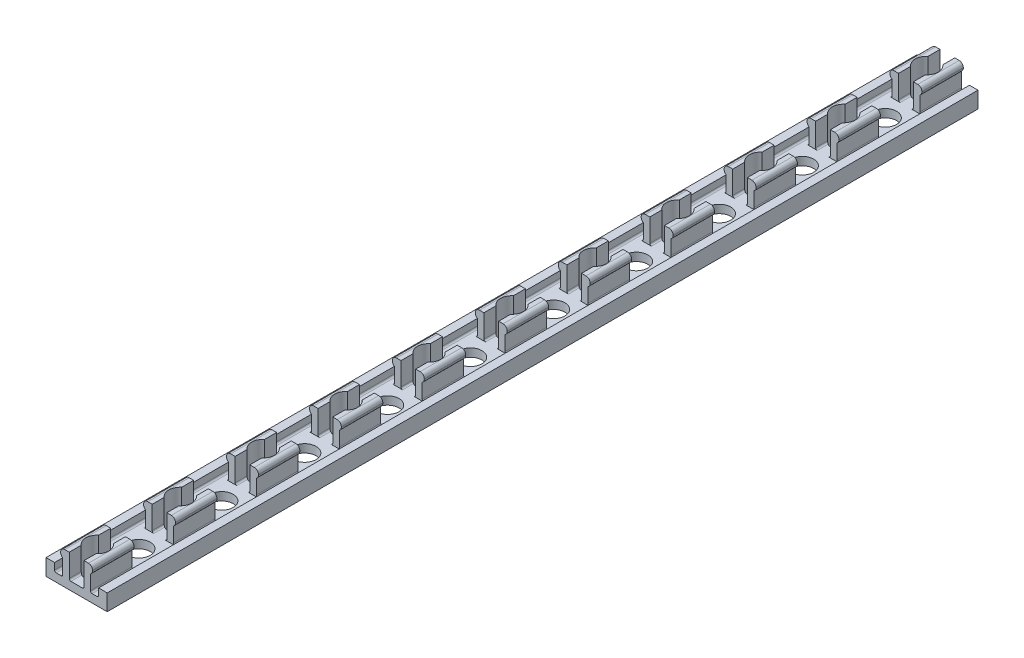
SolidWorks part; units mm, degrees
ref_plane "前视基准面" through (0, 0, 0) normal (0, 0, 1) x (1, 0, 0)
ref_plane "上视基准面" through (0, 0, 0) normal (0, 1, 0) x (1, 0, 0)
ref_plane "右视基准面" through (0, 0, 0) normal (1, 0, 0) x (0, 0, -1)
sketch "草图1" plane through (0, 0, 0) normal (0, 0, 1) x (1, 0, 0)
  line L0 (0, 0) -> (0, 44.5431) construction
  line L1 (-3.75, 0) -> (-3.75, 2)
  line L2 (-3.75, 2) -> (-1.7, 2)
  line L3 (-1.7, 2) -> (-1.7, 3)
  line L4 (-1.7, 3) -> (-1.95, 3)
  line L5 (-1.95, 3) -> (-1.95, 4)
  line L6 (-1.95, 4) -> (1.95, 4)
  line L8 (1.95, 3) -> (1.95, 4)
  line L9 (1.7, 3) -> (1.95, 3)
  line L10 (1.7, 2) -> (1.7, 3)
  line L11 (3.75, 2) -> (1.7, 2)
  line L12 (3.75, 0) -> (3.75, 2)
  line L13 (-3.75, 0) -> (3.75, 0)
  dimension "D1" = 2
  dimension "D2" = 1
  dimension "D3" = 1
  dimension "D4" = 3.4
  dimension "D5" = 7.5
  dimension "D6" = 3.9
extrude "凸台-拉伸1" add sketch "草图1" along normal blind 106.68
sketch "草图2" plane through (0, 0, 0) normal (0, -1, 0) x (1, 0, 0)
  line L0 (0, 106.68) -> (0, 419.4264) construction
  line L1 (-3.75, 106.68) -> (3.75, 106.68) construction
  line L2 (-3.75, 53.34) -> (35.5826, 53.34) construction
  line L3 (-3.75, 106.68) -> (-3.75, 0) construction
  circle A0 centre (0, 104.14) radius 1.4
  circle A1 centre (0, 99.06) radius 1.4
  circle A2 centre (0, 93.98) radius 1.4
  circle A3 centre (0, 88.9) radius 1.4
  circle A4 centre (0, 83.82) radius 1.4
  circle A5 centre (0, 78.74) radius 1.4
  circle A6 centre (0, 73.66) radius 1.4
  circle A7 centre (0, 68.58) radius 1.4
  circle A8 centre (0, 63.5) radius 1.4
  circle A9 centre (0, 58.42) radius 1.4
  circle A10 centre (0, 53.34) radius 1.4
  circle A11 centre (0, 48.26) radius 1.4
  circle A12 centre (0, 43.18) radius 1.4
  circle A13 centre (0, 38.1) radius 1.4
  circle A14 centre (0, 33.02) radius 1.4
  circle A15 centre (0, 27.94) radius 1.4
  circle A16 centre (0, 22.86) radius 1.4
  circle A17 centre (0, 17.78) radius 1.4
  circle A18 centre (0, 12.7) radius 1.4
  circle A19 centre (0, 7.62) radius 1.4
  circle A20 centre (0, 2.54) radius 1.4
  dimension "D1" = 2.8
  dimension "D2" = 2.54
  dimension "D3" = 21
extrude "切除-拉伸4" cut sketch "草图2" against normal blind 10
fillet "圆角1" radius 0.5 4 edges at (1.95, 4, 53.34) (1.95, 3, 53.34) (-1.95, 4, 53.34) (-1.95, 3, 53.34)
sketch "草图4" plane through (0, 0, 0) normal (0, 0, -1) x (-1, 0, 0)
  line L0 (0, 4) -> (0, -2.2655) construction
  line L1 (-1.45, 4) -> (1.45, 4) construction
  line L2 (3.75, 0) -> (-3.75, 0) construction
  line L3 (-0.9, 1.8) -> (0.9, 1.8)
  line L4 (-0.9, 1.8) -> (-0.9, 4.0791)
  line L5 (-0.9, 4.0791) -> (0.9, 4.0791)
  line L6 (0.9, 1.8) -> (0.9, 4.0791)
  line L7 (-0.9, 1.8) -> (0.9, 4.0791) construction
  line L8 (-0.9, 4.0791) -> (0.9, 1.8) construction
  line L9 (-1.7, 2) -> (-1.7, 3) construction
  point P5 (0, 2.9395)
  dimension "D1" = 1.8
  dimension "D2" = 0.8
extrude "切除-拉伸2" cut sketch "草图4" against normal through all
sketch "草图5" plane through (-3.75, 0, 0) normal (-1, 0, 0) x (0, 0, 1)
  line L0 (106.68, 2) -> (0, 2) construction
  line L1 (5.08, 2) -> (10.16, 2)
  line L2 (5.08, 2) -> (5.08, 7)
  line L3 (5.08, 7) -> (10.16, 7)
  line L4 (10.16, 2) -> (10.16, 7)
  line L5 (0, 2) -> (0, 0) construction
  line L6 (15.24, 2) -> (20.32, 2)
  line L7 (15.24, 2) -> (15.24, 7)
  line L8 (15.24, 7) -> (20.32, 7)
  line L9 (20.32, 2) -> (20.32, 7)
  line L10 (25.4, 2) -> (30.48, 2)
  line L11 (25.4, 2) -> (25.4, 7)
  line L12 (25.4, 7) -> (30.48, 7)
  line L13 (30.48, 2) -> (30.48, 7)
  line L14 (35.56, 2) -> (40.64, 2)
  line L15 (35.56, 2) -> (35.56, 7)
  line L16 (35.56, 7) -> (40.64, 7)
  line L17 (40.64, 2) -> (40.64, 7)
  line L18 (45.72, 2) -> (50.8, 2)
  line L19 (45.72, 2) -> (45.72, 7)
  line L20 (45.72, 7) -> (50.8, 7)
  line L21 (50.8, 2) -> (50.8, 7)
  line L22 (55.88, 2) -> (60.96, 2)
  line L23 (55.88, 2) -> (55.88, 7)
  line L24 (55.88, 7) -> (60.96, 7)
  line L25 (60.96, 2) -> (60.96, 7)
  line L26 (66.04, 2) -> (71.12, 2)
  line L27 (66.04, 2) -> (66.04, 7)
  line L28 (66.04, 7) -> (71.12, 7)
  line L29 (71.12, 2) -> (71.12, 7)
  line L30 (76.2, 2) -> (81.28, 2)
  line L31 (76.2, 2) -> (76.2, 7)
  line L32 (76.2, 7) -> (81.28, 7)
  line L33 (81.28, 2) -> (81.28, 7)
  line L34 (86.36, 2) -> (91.44, 2)
  line L35 (86.36, 2) -> (86.36, 7)
  line L36 (86.36, 7) -> (91.44, 7)
  line L37 (91.44, 2) -> (91.44, 7)
  line L38 (96.52, 2) -> (101.6, 2)
  line L39 (96.52, 2) -> (96.52, 7)
  line L40 (96.52, 7) -> (101.6, 7)
  line L41 (101.6, 2) -> (101.6, 7)
  line L42 (106.68, 2) -> (111.76, 2)
  line L43 (106.68, 2) -> (106.68, 7)
  line L44 (106.68, 7) -> (111.76, 7)
  line L45 (111.76, 2) -> (111.76, 7)
  line L46 (116.84, 2) -> (121.92, 2)
  line L47 (116.84, 2) -> (116.84, 7)
  line L48 (116.84, 7) -> (121.92, 7)
  line L49 (121.92, 2) -> (121.92, 7)
  line L50 (127, 2) -> (132.08, 2)
  line L51 (127, 2) -> (127, 7)
  line L52 (127, 7) -> (132.08, 7)
  line L53 (132.08, 2) -> (132.08, 7)
  line L54 (137.16, 2) -> (142.24, 2)
  line L55 (137.16, 2) -> (137.16, 7)
  line L56 (137.16, 7) -> (142.24, 7)
  line L57 (142.24, 2) -> (142.24, 7)
  line L58 (147.32, 2) -> (152.4, 2)
  line L59 (147.32, 2) -> (147.32, 7)
  line L60 (147.32, 7) -> (152.4, 7)
  line L61 (152.4, 2) -> (152.4, 7)
  line L62 (157.48, 2) -> (162.56, 2)
  line L63 (157.48, 2) -> (157.48, 7)
  line L64 (157.48, 7) -> (162.56, 7)
  line L65 (162.56, 2) -> (162.56, 7)
  line L66 (167.64, 2) -> (172.72, 2)
  line L67 (167.64, 2) -> (167.64, 7)
  line L68 (167.64, 7) -> (172.72, 7)
  line L69 (172.72, 2) -> (172.72, 7)
  line L70 (177.8, 2) -> (182.88, 2)
  line L71 (177.8, 2) -> (177.8, 7)
  line L72 (177.8, 7) -> (182.88, 7)
  line L73 (182.88, 2) -> (182.88, 7)
  line L74 (187.96, 2) -> (193.04, 2)
  line L75 (187.96, 2) -> (187.96, 7)
  line L76 (187.96, 7) -> (193.04, 7)
  line L77 (193.04, 2) -> (193.04, 7)
  line L78 (198.12, 2) -> (203.2, 2)
  line L79 (198.12, 2) -> (198.12, 7)
  line L80 (198.12, 7) -> (203.2, 7)
  line L81 (203.2, 2) -> (203.2, 7)
  line L82 (208.28, 2) -> (213.36, 2)
  line L83 (208.28, 2) -> (208.28, 7)
  line L84 (208.28, 7) -> (213.36, 7)
  line L85 (213.36, 2) -> (213.36, 7)
  line L86 (218.44, 2) -> (223.52, 2)
  line L87 (218.44, 2) -> (218.44, 7)
  line L88 (218.44, 7) -> (223.52, 7)
  line L89 (223.52, 2) -> (223.52, 7)
  line L90 (228.6, 2) -> (233.68, 2)
  line L91 (228.6, 2) -> (228.6, 7)
  line L92 (228.6, 7) -> (233.68, 7)
  line L93 (233.68, 2) -> (233.68, 7)
  line L94 (238.76, 2) -> (243.84, 2)
  line L95 (238.76, 2) -> (238.76, 7)
  line L96 (238.76, 7) -> (243.84, 7)
  line L97 (243.84, 2) -> (243.84, 7)
  line L98 (248.92, 2) -> (254, 2)
  line L99 (248.92, 2) -> (248.92, 7)
  line L100 (248.92, 7) -> (254, 7)
  line L101 (254, 2) -> (254, 7)
  line L102 (259.08, 2) -> (264.16, 2)
  line L103 (259.08, 2) -> (259.08, 7)
  line L104 (259.08, 7) -> (264.16, 7)
  line L105 (264.16, 2) -> (264.16, 7)
  line L106 (269.24, 2) -> (274.32, 2)
  line L107 (269.24, 2) -> (269.24, 7)
  line L108 (269.24, 7) -> (274.32, 7)
  line L109 (274.32, 2) -> (274.32, 7)
  line L110 (279.4, 2) -> (284.48, 2)
  line L111 (279.4, 2) -> (279.4, 7)
  line L112 (279.4, 7) -> (284.48, 7)
  line L113 (284.48, 2) -> (284.48, 7)
  line L114 (289.56, 2) -> (294.64, 2)
  line L115 (289.56, 2) -> (289.56, 7)
  line L116 (289.56, 7) -> (294.64, 7)
  line L117 (294.64, 2) -> (294.64, 7)
  line L118 (299.72, 2) -> (304.8, 2)
  line L119 (299.72, 2) -> (299.72, 7)
  line L120 (299.72, 7) -> (304.8, 7)
  line L121 (304.8, 2) -> (304.8, 7)
  line L122 (309.88, 2) -> (314.96, 2)
  line L123 (309.88, 2) -> (309.88, 7)
  line L124 (309.88, 7) -> (314.96, 7)
  line L125 (314.96, 2) -> (314.96, 7)
  line L126 (320.04, 2) -> (325.12, 2)
  line L127 (320.04, 2) -> (320.04, 7)
  line L128 (320.04, 7) -> (325.12, 7)
  line L129 (325.12, 2) -> (325.12, 7)
  line L130 (330.2, 2) -> (335.28, 2)
  line L131 (330.2, 2) -> (330.2, 7)
  line L132 (330.2, 7) -> (335.28, 7)
  line L133 (335.28, 2) -> (335.28, 7)
  line L134 (340.36, 2) -> (345.44, 2)
  line L135 (340.36, 2) -> (340.36, 7)
  line L136 (340.36, 7) -> (345.44, 7)
  line L137 (345.44, 2) -> (345.44, 7)
  line L138 (350.52, 2) -> (355.6, 2)
  line L139 (350.52, 2) -> (350.52, 7)
  line L140 (350.52, 7) -> (355.6, 7)
  line L141 (355.6, 2) -> (355.6, 7)
  line L142 (360.68, 2) -> (365.76, 2)
  line L143 (360.68, 2) -> (360.68, 7)
  line L144 (360.68, 7) -> (365.76, 7)
  line L145 (365.76, 2) -> (365.76, 7)
  line L146 (370.84, 2) -> (375.92, 2)
  line L147 (370.84, 2) -> (370.84, 7)
  line L148 (370.84, 7) -> (375.92, 7)
  line L149 (375.92, 2) -> (375.92, 7)
  line L150 (381, 2) -> (386.08, 2)
  line L151 (381, 2) -> (381, 7)
  line L152 (381, 7) -> (386.08, 7)
  line L153 (386.08, 2) -> (386.08, 7)
  line L154 (391.16, 2) -> (396.24, 2)
  line L155 (391.16, 2) -> (391.16, 7)
  line L156 (391.16, 7) -> (396.24, 7)
  line L157 (396.24, 2) -> (396.24, 7)
  line L158 (401.32, 2) -> (406.4, 2)
  line L159 (401.32, 2) -> (401.32, 7)
  line L160 (401.32, 7) -> (406.4, 7)
  line L161 (406.4, 2) -> (406.4, 7)
  line L162 (411.48, 2) -> (416.56, 2)
  line L163 (411.48, 2) -> (411.48, 7)
  line L164 (411.48, 7) -> (416.56, 7)
  line L165 (416.56, 2) -> (416.56, 7)
  line L166 (421.64, 2) -> (426.72, 2)
  line L167 (421.64, 2) -> (421.64, 7)
  line L168 (421.64, 7) -> (426.72, 7)
  line L169 (426.72, 2) -> (426.72, 7)
  dimension "D1" = 5.08
  dimension "D2" = 5.08
  dimension "D4" = 5.08
  dimension "D5" = 5
  dimension "D3" = 42
extrude "切除-拉伸3" cut sketch "草图5" against normal through all
sketch "草图8" plane through (0, 0, 0) normal (0, -1, 0) x (1, 0, 0)
  line L0 (-3.75, 106.68) -> (-3.75, 0) construction
  line L3 (-3.45, 44.4851) -> (-3.45, 32.1142) construction
  text T2 "1013006" font "黑体" height 1.5
  dimension "D1" = 0.3
sketch_block_instance "公司LOGO-5"
sketch_block "公司LOGO"
extrude "切除-拉伸7" cut sketch "草图8" against normal blind 0.2
sketch "草图9" plane through (0, 0, 106.68) normal (0, 0, 1) x (1, 0, 0)
  line L0 (-1.7, 2) -> (-3.75, 2) construction
  line L1 (-2.7, 2) -> (-1.7, 2)
  line L2 (-2.7, 2) -> (-2.7, 1.2)
  line L3 (-2.5, 1) -> (-1.9, 1)
  line L4 (-1.7, 2) -> (-1.7, 1.2)
  line L5 (-1.7, 3) -> (-1.7, 2) construction
  line L6 (0.9, 4) -> (0.9, 1.8) construction
  line L7 (-0.9, 1.8) -> (0.9, 1.8)
  line L8 (-0.9, 1.8) -> (-0.9, 1.2)
  line L9 (-0.7, 1) -> (0.7, 1)
  line L10 (0.9, 1.8) -> (0.9, 1.2)
  line L11 (0, 0) -> (0, 2.7989) construction
  line L12 (1.7, 2) -> (1.7, 1.2)
  line L13 (2.5, 1) -> (1.9, 1)
  line L14 (2.7, 2) -> (2.7, 1.2)
  line L15 (2.7, 2) -> (1.7, 2)
  arc A0 (2.7, 1.2) -> (2.5, 1) centre (2.5, 1.2) cw
  arc A1 (1.7, 1.2) -> (1.9, 1) centre (1.9, 1.2) ccw
  arc A2 (0.9, 1.2) -> (0.7, 1) centre (0.7, 1.2) cw
  arc A3 (-0.7, 1) -> (-0.9, 1.2) centre (-0.7, 1.2) cw
  arc A4 (-1.7, 1.2) -> (-1.9, 1) centre (-1.9, 1.2) cw
  arc A5 (-2.7, 1.2) -> (-2.5, 1) centre (-2.5, 1.2) ccw
  point P24 (2.7, 1)
  point P27 (1.7, 1)
  point P34 (-1.7, 1)
  point P37 (-2.7, 1)
  dimension "D3" = 0.2
  dimension "D1" = 1
  dimension "D2" = 1
extrude "切除-拉伸8" cut sketch "草图9" against normal through all
sketch "草图10" plane through (0, 2, 0) normal (0, 1, 0) x (1, 0, 0)
  line L133 (-1.9, -96.52) -> (1.9, -96.52)
  line L134 (-1.9, -96.52) -> (-1.9, -101.6)
  line L135 (-1.9, -101.6) -> (1.9, -101.6)
  line L136 (1.9, -96.52) -> (1.9, -101.6)
  line L137 (-1.9, -86.36) -> (1.9, -86.36)
  line L138 (-1.9, -86.36) -> (-1.9, -91.44)
  line L139 (-1.9, -91.44) -> (1.9, -91.44)
  line L140 (1.9, -86.36) -> (1.9, -91.44)
  line L141 (-1.9, -76.2) -> (1.9, -76.2)
  line L142 (-1.9, -76.2) -> (-1.9, -81.28)
  line L143 (-1.9, -81.28) -> (1.9, -81.28)
  line L144 (1.9, -76.2) -> (1.9, -81.28)
  line L145 (-1.9, -66.04) -> (1.9, -66.04)
  line L146 (-1.9, -66.04) -> (-1.9, -71.12)
  line L147 (-1.9, -71.12) -> (1.9, -71.12)
  line L148 (1.9, -66.04) -> (1.9, -71.12)
  line L149 (-1.9, -55.88) -> (1.9, -55.88)
  line L150 (-1.9, -55.88) -> (-1.9, -60.96)
  line L151 (-1.9, -60.96) -> (1.9, -60.96)
  line L152 (1.9, -55.88) -> (1.9, -60.96)
  line L153 (-1.9, -45.72) -> (1.9, -45.72)
  line L154 (-1.9, -45.72) -> (-1.9, -50.8)
  line L155 (-1.9, -50.8) -> (1.9, -50.8)
  line L156 (1.9, -45.72) -> (1.9, -50.8)
  line L157 (-1.9, -35.56) -> (1.9, -35.56)
  line L158 (-1.9, -35.56) -> (-1.9, -40.64)
  line L159 (-1.9, -40.64) -> (1.9, -40.64)
  line L160 (1.9, -35.56) -> (1.9, -40.64)
  line L161 (-1.9, -25.4) -> (1.9, -25.4)
  line L162 (-1.9, -25.4) -> (-1.9, -30.48)
  line L163 (-1.9, -30.48) -> (1.9, -30.48)
  line L164 (1.9, -25.4) -> (1.9, -30.48)
  line L165 (-1.9, -15.24) -> (1.9, -15.24)
  line L166 (-1.9, -15.24) -> (-1.9, -20.32)
  line L167 (-1.9, -20.32) -> (1.9, -20.32)
  line L168 (1.9, -15.24) -> (1.9, -20.32)
  line L169 (-1.9, -5.08) -> (1.9, -5.08)
  line L170 (-1.9, -5.08) -> (-1.9, -10.16)
  line L171 (-1.9, -10.16) -> (1.9, -10.16)
  line L172 (1.9, -5.08) -> (1.9, -10.16)
extrude "切除-拉伸9" cut sketch "草图10" against normal up to surface (1 mm away)
